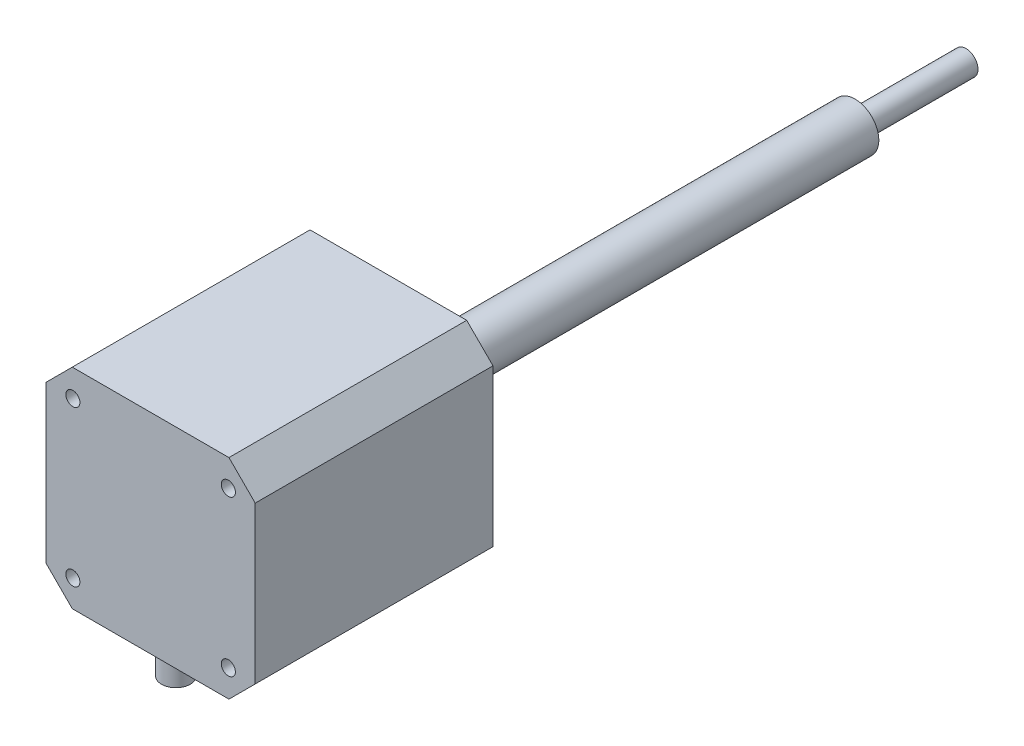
SolidWorks part; units mm, degrees
ref_plane "Front" through (0, 0, 0) normal (0, 0, 1) x (1, 0, 0)
ref_plane "Top" through (0, 0, 0) normal (0, 1, 0) x (1, 0, 0)
ref_plane "Right" through (0, 0, 0) normal (1, 0, 0) x (0, 0, -1)
sketch "Sketch1" plane through (0, 0, 0) normal (0, 0, 1) x (1, 0, 0)
  line L0 (-20.955, 20.955) -> (20.955, 20.955)
  line L1 (-20.955, 20.955) -> (-20.955, -20.955)
  line L2 (20.955, -20.955) -> (-20.955, -20.955)
  line L3 (20.955, -20.955) -> (20.955, 20.955)
  dimension "D1" = 20.955
  dimension "D2" = 41.91
  dimension "D3" = 20.955
  dimension "D4" = 41.91
extrude "Base-Extrude" add sketch "Sketch1" along normal blind 47.625
sketch "Sketch2" plane through (0, 0, 47.625) normal (0, 0, 1) x (1, 0, 0)
  line L0 (15.7052, 15.7052) -> (-15.7052, -15.7052) construction
  line L1 (0, 0) -> (0, -6.1879) construction
  line L2 (-15.8402, 15.8402) -> (15.5702, -15.5702) construction
  line L3 (20.741, -15.9045) -> (15.9409, -20.7045)
  line L4 (20.955, -20.955) -> (-20.955, -20.955) construction
  line L5 (20.741, -15.9045) -> (24.0932, -12.5523)
  line L6 (15.9409, -20.7045) -> (13.5636, -23.0819)
  line L7 (13.5636, -23.0819) -> (24.0932, -23.0819)
  line L8 (24.0932, -23.0819) -> (24.0932, -12.5523)
  line L9 (-20.7045, 15.9409) -> (-23.0819, 13.5636)
  line L10 (-15.9045, 20.741) -> (-20.7045, 15.9409)
  line L11 (-23.0819, 13.5636) -> (-23.0819, 24.0932)
  line L12 (-23.0819, 24.0932) -> (-12.5523, 24.0932)
  line L13 (-15.9045, 20.741) -> (-12.5523, 24.0932)
  line L14 (0, 0) -> (24.0932, 0) construction
  line L15 (-23.0819, -13.5636) -> (-23.0819, -24.0932)
  line L16 (-23.0819, -24.0932) -> (-12.5523, -24.0932)
  line L17 (-15.9045, -20.741) -> (-12.5523, -24.0932)
  line L18 (-15.9045, -20.741) -> (-20.7045, -15.9409)
  line L19 (-20.7045, -15.9409) -> (-23.0819, -13.5636)
  line L20 (13.5636, 23.0819) -> (24.0932, 23.0819)
  line L21 (15.9409, 20.7045) -> (13.5636, 23.0819)
  line L22 (20.741, 15.9045) -> (15.9409, 20.7045)
  line L23 (20.741, 15.9045) -> (24.0932, 12.5523)
  line L24 (24.0932, 23.0819) -> (24.0932, 12.5523)
  line L25 (0, 24.0932) -> (0, -41.2134) construction
  circle A1 centre (15.5702, 15.5702) radius 1.4097
  circle A2 centre (15.5702, -15.5702) radius 1.4097
  circle A3 centre (-15.5702, 15.5702) radius 1.4097
  circle A4 centre (-15.5702, -15.5702) radius 1.4097
  dimension "D1" = 45
  dimension "D2" = 2.8194
  dimension "D3" = 31.1404
  dimension "D4" = 15.5702
  dimension "D5" = 15.5702
extrude "Cut-Extrude2" cut sketch "Sketch2" against normal through all
sketch "Sketch4" plane through (0, -20.955, 0) normal (0, 1, 0) x (-1, 0, 0)
  line L0 (0, 58.4946) -> (0, -14.1926) construction
  line L2 (-35.4238, 42.5538) -> (28.9266, 42.5538) construction
  line L3 (15.6905, 47.625) -> (-15.6905, 47.625) construction
  circle A0 centre (0, 42.5538) radius 2.8956
  dimension "D2" = 5.7912
  dimension "D1" = 5.0712
extrude "Boss-Extrude2" add sketch "Sketch4" against normal blind 6.35
sketch "Sketch6" plane through (0, 0, 0) normal (1, 0, 0) x (0, 0, -1)
  line L0 (0, 3.175) -> (12.7, 3.175)
  line L1 (0, -15.6905) -> (0, 15.6905) construction
  line L2 (12.7, 3.175) -> (12.7, 4.7625)
  line L3 (12.7, 4.7625) -> (93.472, 4.7625)
  line L4 (93.472, 4.7625) -> (93.472, 2.413)
  line L7 (93.472, 2.413) -> (115.697, 2.413)
  line L8 (115.697, 2.413) -> (115.697, 0)
  line L9 (0, 3.175) -> (0, 0)
  line L10 (0, 0) -> (115.697, 0)
  line L11 (0, 0) -> (-9.4932, 0) construction
  dimension "D1" = 3.175
  dimension "D2" = 4.7625
  dimension "D3" = 12.7
  dimension "D4" = 93.472
  dimension "D5" = 22.225
  dimension "D7" = 2.413
revolve "Boss-Revolve1" add sketch "Sketch6" angle 360 about L11
sketch "Sketch7" [suppressed] plane through (20.955, 0, 0) normal (1, 0, 0) x (0, 0, -1)
  line L0 (12.7, 3.175) -> (12.7, -3.175) construction
  line L1 (-54.22, 25.8281) -> (12.7, 25.8281)
  line L2 (-54.22, 25.8281) -> (-54.22, -32.0451)
  line L3 (-54.22, -32.0451) -> (12.7, -32.0451)
  line L4 (12.7, 25.8281) -> (12.7, -32.0451)
extrude "Cut-Extrude3" [suppressed] cut sketch "Sketch7" against normal through all
